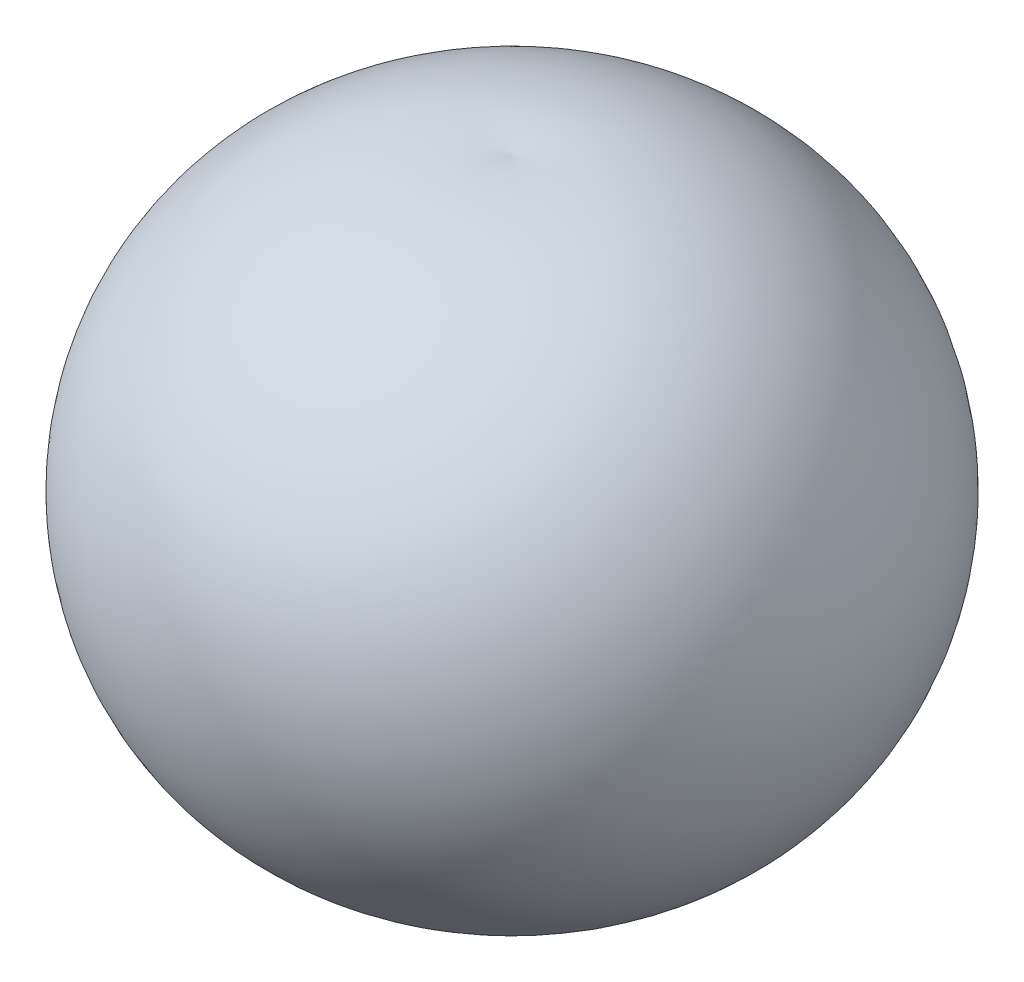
SolidWorks part; units mm, degrees
ref_plane "前视基准面" through (0, 0, 0) normal (0, 0, 1) x (1, 0, 0)
ref_plane "上视基准面" through (0, 0, 0) normal (0, 1, 0) x (1, 0, 0)
ref_plane "右视基准面" through (0, 0, 0) normal (1, 0, 0) x (0, 0, -1)
sketch "草图1" plane through (0, 0, 0) normal (0, 0, 1) x (1, 0, 0)
  line L0 (0, 0) -> (0, 102.5158) construction
  line L1 (185, 420) -> (-1020.9143, 420) construction
  line L2 (185, 420) -> (-1087.4348, 531.3236) construction
  line L3 (185, 420) -> (185, -1522.0856) construction
  line L4 (185, 420) -> (1201.6061, -1340.8134) construction
  line L5 (0, -1449.8706) -> (0, 2829.9363) construction
  line L6 (0, -899.8391) -> (0, 59.8853)
  line L7 (0, 1312.0839) -> (0, 1944.5423)
  arc A0 (-203.4328, 534.1382) -> (501.2924, 672.7185) centre (185, 420) ccw construction
  arc A1 (952.863, -909.9777) -> (-1344.8821, 553.8473) centre (185, 420) ccw construction
  arc A2 (-1344.8821, 553.8473) -> (-377.3835, -462.7652) centre (-412.7168, 472.2934) ccw construction
  arc A3 (-203.4328, 534.1382) -> (-406.767, -383.0491) centre (485, -99.6152) ccw construction
  arc A4 (-377.3835, -462.7652) -> (952.863, -909.9777) centre (485, -99.6152) ccw construction
  arc A5 (0, 1944.5423) -> (952.863, -909.9777) centre (185, 420) cw
  arc A6 (-133.3957, 1365.3572) -> (-406.767, -383.0491) centre (185, 420) ccw construction
  arc A7 (501.2924, 672.7185) -> (-133.3957, 1365.3572) centre (-412.7168, 472.2934) ccw construction
  arc A8 (952.863, -909.9777) -> (0, -899.8391) centre (485, -99.6152) cw
  arc A9 (0, 59.8853) -> (501.2924, 672.7185) centre (185, 420) ccw
  arc A10 (501.2924, 672.7185) -> (0, 1312.0839) centre (-412.7168, 472.2934) ccw
  dimension "D2" = 809.71
  dimension "D6" = 1871.452
  dimension "D7" = 30
  dimension "D8" = 997.535
  dimension "D11" = 935.726
  dimension "D3" = 185
  dimension "D4" = 420
  dimension "D5" = 600
  dimension "D9" = 600
  dimension "D10" = 5
ref_axis "基准轴1" through (0, 2129.6166, 0) along (0, -1, 0)
revolve "旋转2" add sketch "草图1" angle 360 mid plane about axis through (0, 2129.6166, 0) along (0, -1, 0)
